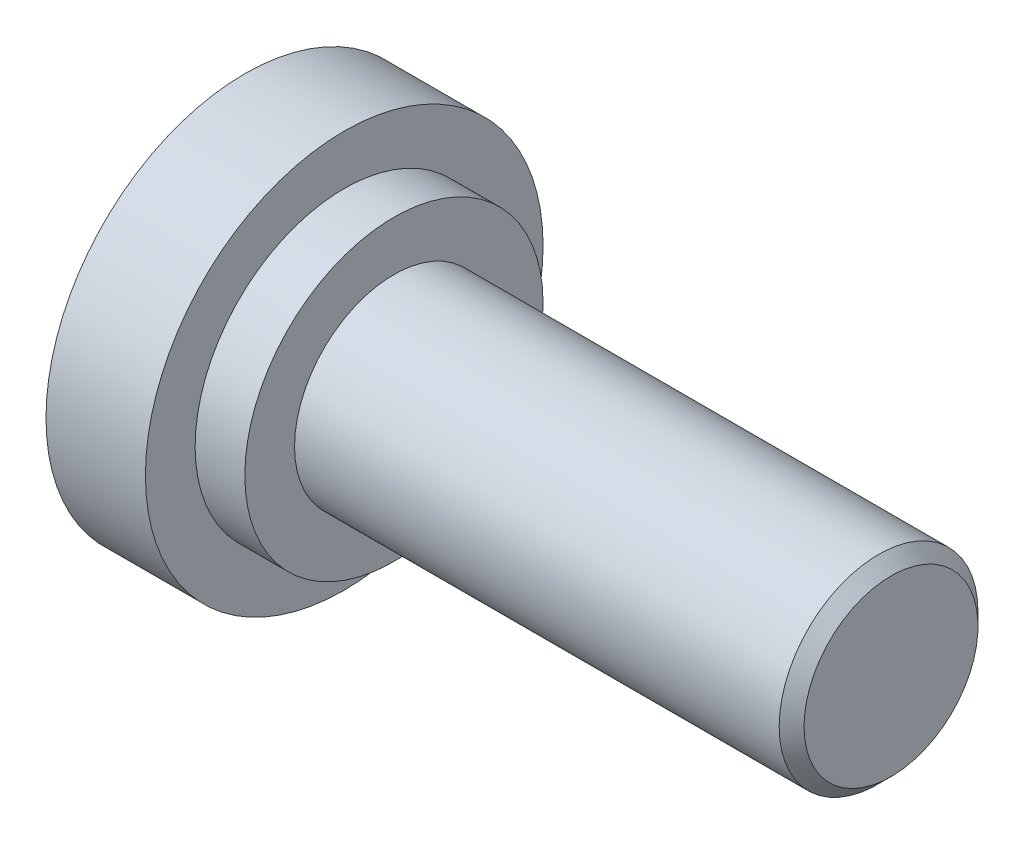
SolidWorks part; units mm, degrees
ref_plane "Plan1" through (0, 0, 0) normal (0, 0, 1) x (1, 0, 0)
ref_plane "Plan2" through (0, 0, 0) normal (0, 1, 0) x (1, 0, 0)
ref_plane "Plan3" through (0, 0, 0) normal (1, 0, 0) x (0, 0, -1)
sketch "Esquisse1" plane through (0, 0, 0) normal (0, 0, 1) x (1, 0, 0)
  line L0 (0, 0) -> (0, 8)
  line L1 (0, 8) -> (4, 8)
  line L2 (4, 8) -> (4, 6)
  line L3 (4, 6) -> (6, 6)
  line L4 (6, 6) -> (6, 4)
  line L5 (6, 4) -> (26, 4)
  line L6 (26, 4) -> (26, 0)
  line L7 (26, 0) -> (0, 0)
  line L8 (-4.1802, 0) -> (31.8979, 0) construction
  dimension "D1" = 8
  dimension "D2" = 4
  dimension "D3" = 2
  dimension "D4" = 20
  dimension "D5" = 6
  dimension "D6" = 4
revolve "Base-Révolution" add sketch "Esquisse1" angle 360 about L8
chamfer "Chanfrein1" distance 0.5 angle 45
